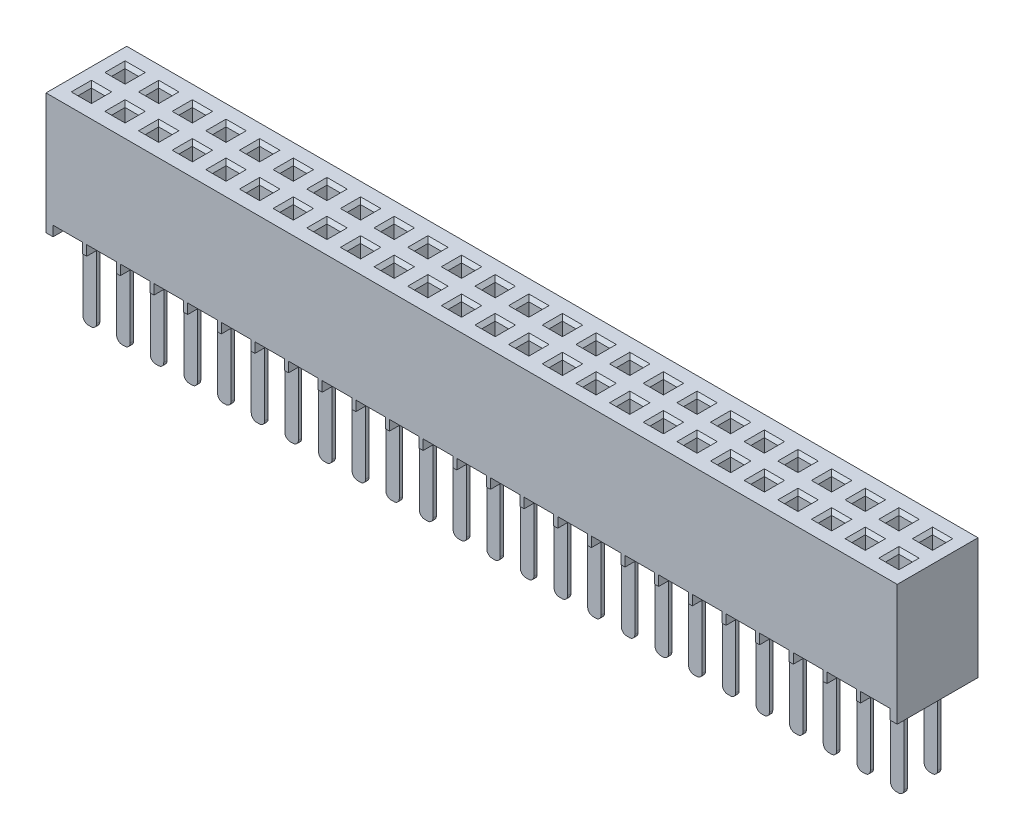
SolidWorks part; units mm, degrees
ref_plane "Front" through (0, 0, 0) normal (0, 0, 1) x (1, 0, 0)
ref_plane "Top" through (0, 0, 0) normal (0, 1, 0) x (1, 0, 0)
ref_plane "Right" through (0, 0, 0) normal (1, 0, 0) x (0, 0, -1)
ref_plane "Plate_Plane" through (0.8255, 0, 0) normal (1, 0, 0) x (0, 0, -1)
ref_plane "Metal_Place_Pad_Position_Plane" through (16.0655, 0, 0) normal (1, 0, 0) x (0, 0, -1)
ref_plane "End_Wall_2_Plane" through (32.131, 0, 0) normal (1, 0, 0) x (0, 0, -1)
ref_plane "Upper_Body_Plane" through (0, 4.572, 0) normal (0, 1, 0) x (-1, 0, 0)
sketch "Sketch1" plane through (0.8255, 0, 0) normal (1, 0, 0) x (0, 0, -1)
  line L0 (0, 0) -> (0, 3.6372) construction
  line L1 (0, 4.191) -> (0, -4.191) construction
  line L2 (2.5336, 0) -> (-2.5336, 0) construction
  line L3 (-1.524, 0) -> (1.524, 0)
  line L4 (-1.524, 0) -> (-1.524, 4.572)
  line L5 (-1.524, 4.572) -> (1.524, 4.572)
  line L6 (1.524, 0) -> (1.524, 4.572)
  line L9 (2.5336, 4.572) -> (-2.5336, 4.572) construction
  dimension "D2" = 3.048
extrude "Main_Body" add sketch "Sketch1" along normal mid plane 1.27
sketch "Sketch2" plane through (0, 4.572, 0) normal (0, 1, 0) x (1, 0, 0)
  line L2 (0.8255, -1.524) -> (0.8255, 1.524) construction
  line L5 (0, 0) -> (1.4605, 0) construction
  line L6 (-4.191, 0) -> (4.191, 0) construction
  line L8 (1.0795, -0.381) -> (1.0795, -0.889)
  line L9 (0.5715, 0.381) -> (1.0795, 0.381)
  line L10 (0.5715, 0.381) -> (0.5715, 0.889)
  line L11 (0.5715, 0.889) -> (1.0795, 0.889)
  line L12 (1.0795, 0.381) -> (1.0795, 0.889)
  line L13 (0.5715, -0.889) -> (1.0795, -0.889)
  line L14 (0.5715, -0.381) -> (0.5715, -0.889)
  line L15 (0.5715, -0.381) -> (1.0795, -0.381)
  line L16 (1.4605, 1.524) -> (0.1905, 1.524) construction
  line L17 (1.4605, -1.524) -> (0.1905, -1.524) construction
  line L18 (1.4605, 1.524) -> (1.4605, -1.524) construction
  point P17 (1.0795, 0.635)
  point P18 (1.0795, -0.635)
  point P19 (0.8255, 0.889)
  point P24 (0.8255, -0.889)
  dimension "D1" = 1.27
  dimension "D2" = 0.508
extrude "Square_Slot" cut sketch "Sketch2" against normal blind 0.762
chamfer "Chamfer1" distance 0.127 angle 45 8 edges at (0.5715, 4.572, -0.635) (0.8255, 4.572, -0.381) (1.0795, 4.572, -0.635) (0.8255, 4.572, -0.889) (0.8255, 4.572, 0.381) (0.5715, 4.572, 0.635) (0.8255, 4.572, 0.889) (1.0795, 4.572, 0.635)
sketch "Sketch20" plane through (0, 0, 0) normal (0, 0, 1) x (1, 0, 0)
  line L0 (1.4605, 0) -> (0.1905, 0) construction
  line L1 (0.2667, 0) -> (1.3843, 0) construction
  line L2 (0.2667, 0) -> (0.2667, 0.381)
  line L3 (0.2667, 0.381) -> (1.3843, 0.381)
  line L4 (1.3843, 0) -> (1.3843, 0.381)
  line L5 (1.4605, 0) -> (0.1905, 0) construction
  line L6 (1.4605, 4.572) -> (1.4605, 0) construction
  line L7 (0.2667, 0) -> (1.3843, 0)
  point P7 (0.8255, 0)
  dimension "D1" = 0.381
  dimension "D2" = 0.0762
extrude "Cut-Extrude1" cut sketch "Sketch20" against normal through all and the other way through all
pattern_linear "Slot_Pattern" count 25 spacing 1.27 along (1, 0, 0) of "Cut-Extrude1", "Main_Body", "Square_Slot", "Chamfer1"
sketch "Sketch17" plane through (0, 0, 0) normal (1, 0, 0) x (0, 0, -1)
  line L0 (-1.524, 0) -> (1.524, 0) construction
  line L1 (1.524, 0) -> (1.524, 4.572) construction
  line L2 (-1.524, 4.572) -> (1.524, 4.572) construction
  line L3 (-1.524, 0) -> (-1.524, 4.572) construction
  line L4 (-1.524, 0) -> (1.524, 0)
  line L5 (1.524, 0) -> (1.524, 4.572)
  line L6 (-1.524, 4.572) -> (1.524, 4.572)
  line L7 (-1.524, 0) -> (-1.524, 4.572)
extrude "End_Wall_1" add sketch "Sketch17" along normal up to next
sketch "Sketch16" plane through (32.131, 0, 0) normal (1, 0, 0) x (0, 0, -1)
  line L7 (-1.524, 0) -> (1.524, 0)
  line L10 (1.524, 0) -> (1.524, 4.572)
  line L11 (1.524, 4.572) -> (-1.524, 4.572)
  line L12 (-1.524, 4.572) -> (-1.524, 0)
  line L13 (-1.524, 0) -> (1.524, 0)
  line L16 (1.524, 0) -> (1.524, 4.572)
  line L17 (1.524, 4.572) -> (-1.524, 4.572)
  line L18 (-1.524, 4.572) -> (-1.524, 0)
  dimension "D1" = 0
extrude "End_Wall_2" add sketch "Sketch16" against normal up to next
sketch "Sketch11" plane through (0.8255, 0, 0) normal (1, 0, 0) x (0, 0, -1)
  line L1 (-2.0955, 0) -> (-2.0955, -0.127) construction
  line L2 (0, 0) -> (0, 3.3578) construction
  line L3 (-2.2225, -0.127) -> (-2.2225, 4.572) construction
  line L4 (-0.398, 0) -> (-2.0955, 0)
  line L5 (-2.0955, -0.127) -> (-2.2225, -0.127) construction
  line L6 (-0.271, 0.6691) -> (0.271, 0.6691)
  line L7 (-0.271, 0.127) -> (-0.271, 0.6691)
  line L8 (0.271, 0.127) -> (0.271, 0.6691)
  line L9 (-2.2225, -0.127) -> (2.0955, -0.127) construction
  line L23 (0.398, 0) -> (2.0955, 0)
  arc A0 (-0.271, 0.127) -> (-0.398, 0) centre (-0.398, 0.127) cw
  arc A3 (0.271, 0.127) -> (0.398, 0) centre (0.398, 0.127) ccw
  point P9 (-2.0955, 0)
  dimension "D1" = 0.6691
  dimension "D2" = 4.699
  dimension "D3" = 0.127
  dimension "D7" = 4.191
  dimension "h" = 0.127
sketch "Sketch14" plane through (-3.1115, 4.572, 0) normal (0, -1, 0) x (0, 0, -1)
  line L0 (0, 14.1732) -> (0, 0) construction
  line L1 (1.6402, 19.177) -> (-1.6402, 19.177) construction
  line L4 (-2.8575, 24.1808) -> (2.8575, 24.1808)
  line L6 (-2.8575, 24.1808) -> (-2.8575, 14.1732)
  line L7 (-2.8575, 14.1732) -> (2.8575, 14.1732)
  line L8 (2.8575, 24.1808) -> (2.8575, 14.1732)
  line L11 (0, 7.3025) -> (0, -1.0795) construction
  point P10 (2.8575, 19.177)
  dimension "D1" = 5.715
  dimension "D2" = 10.0076
sketch "Sketch19" plane through (16.0655, 0, 0) normal (-1, 0, 0) x (0, 0, 1)
  line L0 (-1.524, 2.6035) -> (-1.524, 1.778)
  line L1 (1.524, 4.572) -> (-1.524, 4.572) construction
  line L2 (1.651, 3.8735) -> (1.524, 3.8735)
  line L4 (-1.524, 0) -> (-1.524, 4.572) construction
  line L5 (-1.524, 3.8735) -> (-1.524, 3.5433)
  line L6 (0, 1.0837) -> (0, 4.5417) construction
  line L7 (-1.524, 3.5433) -> (-1.524, 3.7084) construction
  line L8 (-1.651, 4.572) -> (-1.651, 3.8735)
  line L9 (-2.286, 4.572) -> (-2.031, 1.7551)
  line L10 (1.524, 3.8735) -> (1.524, 3.5433)
  line L11 (-1.651, 4.572) -> (-2.286, 4.572)
  line L12 (-1.651, 3.5433) -> (-1.524, 3.5433)
  line L13 (-1.524, 2.6035) -> (-1.524, 2.4384) construction
  line L14 (-1.651, 3.8735) -> (-1.524, 3.8735)
  line L15 (-1.651, 3.5433) -> (-1.651, 2.6035)
  line L16 (-1.651, 2.6035) -> (-1.524, 2.6035)
  line L17 (1.651, 3.5433) -> (1.524, 3.5433)
  line L18 (1.651, 2.6035) -> (1.524, 2.6035)
  line L19 (1.651, 4.572) -> (1.651, 3.8735)
  line L20 (1.651, 3.5433) -> (1.651, 2.6035)
  line L21 (1.524, 2.6035) -> (1.524, 1.778)
  line L22 (2.286, 4.572) -> (2.031, 1.7551)
  line L23 (1.651, 4.572) -> (2.286, 4.572)
  arc A0 (2.031, 1.7551) -> (1.524, 1.778) centre (1.778, 1.778) cw
  arc A1 (-2.031, 1.7551) -> (-1.524, 1.778) centre (-1.778, 1.778) ccw
  point P17 (-1.524, 3.7084)
  point P22 (-1.524, 2.4384)
  dimension "D2" = 0.254
  dimension "D1" = 3.048
  dimension "D3" = 4.572
  dimension "D4" = 0.127
  dimension "D5" = 0.8636
  dimension "D6" = 1.27
  dimension "D7" = 0.3302
sketch "Sketch21" plane through (0.8255, 0, 0) normal (1, 0, 0) x (0, 0, -1)
  line L1 (0.5715, 0.381) -> (0.6985, 0.381)
  line L2 (0.5715, 0.381) -> (0.5715, -3.048)
  line L3 (0.5715, -3.048) -> (0.6985, -3.048)
  line L4 (0.6985, 0.381) -> (0.6985, -3.048)
  line L5 (-1.524, 0) -> (1.524, 0) construction
  line L6 (0, 0) -> (0, 3.6372) construction
  line L7 (0, 0) -> (0, 3.6372) construction
  line L8 (-0.6985, 0.381) -> (-0.6985, -3.048)
  line L9 (-0.5715, -3.048) -> (-0.6985, -3.048)
  line L10 (-0.5715, 0.381) -> (-0.5715, -3.048)
  line L11 (-0.5715, 0.381) -> (-0.6985, 0.381)
  point P8 (0.635, 0.381)
  point P15 (-0.635, 0.381)
  dimension "D1" = 0.127
  dimension "A" = 3.048
extrude "PinStraight" add sketch "Sketch21" along normal mid plane 0.508
fillet "Fillet1" radius 0.2032 4 edges at (0.5715, -3.048, -0.635) (1.0795, -3.048, -0.635) (0.5715, -3.048, 0.635) (1.0795, -3.048, 0.635)
pattern_linear "LPattern1" count 25 spacing 1.27 along (1, 0, 0) of "PinStraight", "Fillet1"
